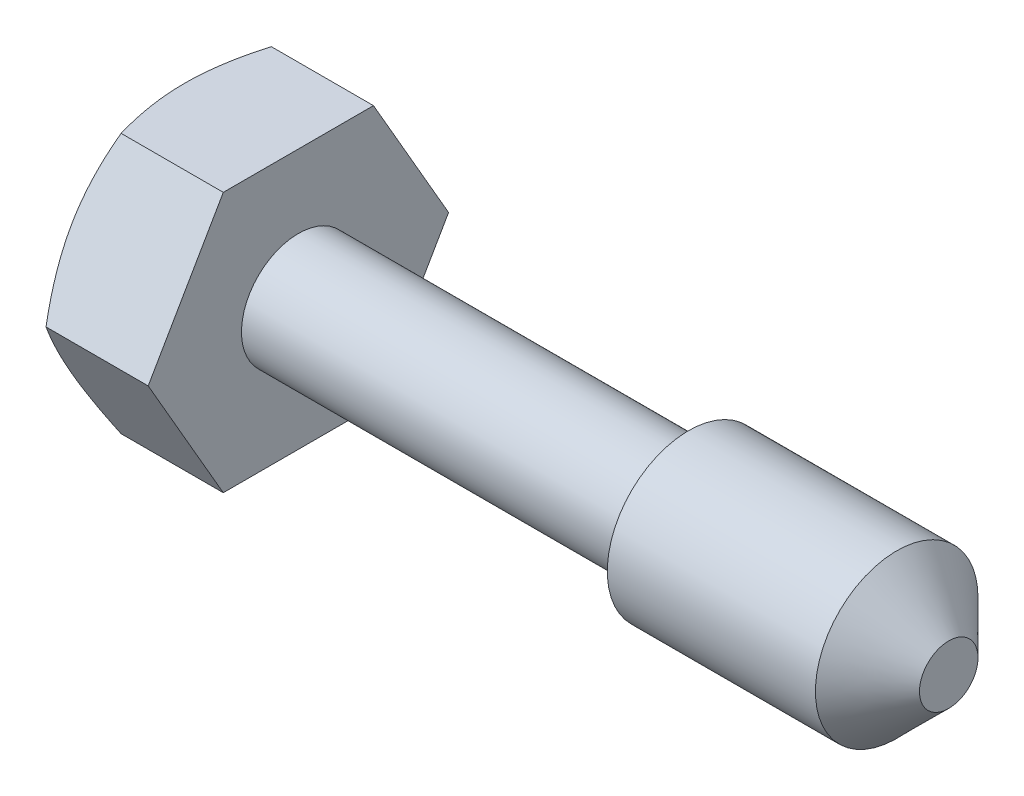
SolidWorks part; units mm, degrees
ref_plane "Front" through (0, 0, 0) normal (0, 0, 1) x (1, 0, 0)
ref_plane "Top" through (0, 0, 0) normal (0, 1, 0) x (1, 0, 0)
ref_plane "Right" through (0, 0, 0) normal (1, 0, 0) x (0, 0, -1)
sketch "Sketch1" plane through (0, 0, 0) normal (1, 0, 0) x (0, 0, -1)
  line L1 (-2.3094, 4) -> (-4.6188, 0)
  line L2 (-4.6188, 0) -> (-2.3094, -4)
  line L3 (-2.3094, -4) -> (2.3094, -4)
  line L4 (2.3094, -4) -> (4.6188, 0)
  line L5 (4.6188, 0) -> (2.3094, 4)
  line L6 (2.3094, 4) -> (-2.3094, 4)
  circle A0 centre (0, 0) radius 4 construction
extrude "BaseHead" add sketch "Sketch1" along normal blind 3.5
sketch "Sketch2" plane through (3.5, 0.5149, -0.9755) normal (1, 0, 0) x (0, 0, -1)
  circle A0 centre (-0.9755, -0.5149) radius 1.75
  circle A1 centre (-0.9755, -0.5149) radius 4 construction
  dimension "d1" = 3.5
extrude "BaseBody" add sketch "Sketch2" along normal blind 20
sketch "Sketch3" plane through (23.5, -0.5708, -0.3491) normal (1, 0, 0) x (0, 0, -1)
  circle A0 centre (-0.3491, 0.5708) radius 2.5
  circle A1 centre (-0.3491, 0.5708) radius 1.75 construction
  dimension "d" = 5
extrude "BaseEnd" add sketch "Sketch3" against normal blind 8
chamfer "Chamfer1" distance 1.6 angle 45 1 edges at (23.5, 0, -2.5)
fillet "Fillet" [suppressed] radius 0.2
sketch "Sketch4" plane through (4.3242, 0, -10.2946) normal (0, 1, 0) x (0, 0, 1)
  line L0 (10.2946, 11.4914) -> (10.2946, -5.5211) construction
  line L2 (14.2946, -4.3242) -> (24.9134, 1.8065)
  line L4 (24.9134, -4.3242) -> (14.2946, -4.3242)
  line L5 (24.9134, -4.3242) -> (24.9134, 1.8065)
  line L6 (12.604, -4.3242) -> (14.9134, -4.3242) construction
  line L8 (14.9134, -0.8242) -> (14.9134, -4.3242) construction
  dimension "D1" = 30
  dimension "D2" = 10
revolve "Cut-Revolve1" cut sketch "Sketch4" angle 360 about L0
sketch "Sketch5" plane through (0, 0, 0) normal (0, 0, 1) x (1, 0, 0)
  line L0 (15.5, 2.2835) -> (15.625, 2.5)
  line L1 (15.625, 2.5) -> (15.625, 2.75)
  line L2 (15.625, 2.75) -> (15.375, 2.75)
  line L3 (15.375, 2.75) -> (15.375, 2.5)
  line L4 (15.375, 2.5) -> (15.5, 2.2835)
  line L5 (15.5, 2.5) -> (15.5, -2.5) construction
  line L6 (0, 0) -> (18.9926, 0) construction
  dimension "D1" = 5
  dimension "D2" = 0.25
revolve "Cut-Revolve10" [suppressed] cut sketch "Sketch5" angle 360 about L6
pattern_linear "LPattern10" [suppressed] count 27 spacing 0.3 along (1, 0, 0)
equation "\"D1@Sketch5\" = \"d@Sketch3\""
equation "\"D2@Sketch5\" =  ( \"d@Sketch3\" - \"THD_MINOR@ThreadCosmetic1\" )  / 2"
equation "\"D3@LPattern10\" = \"D2@Sketch5\" * 1.2"
equation "\"D1@LPattern10\" = \"b@BaseEnd\" / \"D3@LPattern10\""
